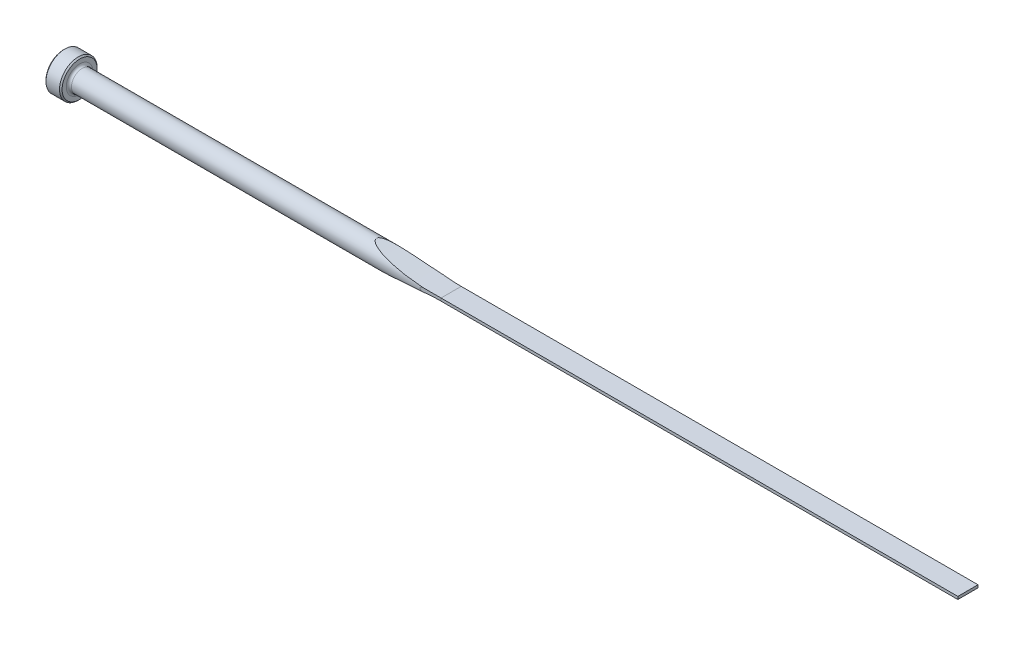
SolidWorks part; units mm, degrees
ref_plane "Front Plane" through (0, 0, 0) normal (0, 0, 1) x (1, 0, 0)
ref_plane "Top Plane" through (0, 0, 0) normal (0, 1, 0) x (1, 0, 0)
ref_plane "Right Plane" through (0, 0, 0) normal (1, 0, 0) x (0, 0, -1)
sketch "Sketch1" plane through (0, 0, 0) normal (0, 0, 1) x (1, 0, 0)
  line L0 (0, 0) -> (175.5286, 0) construction
  line L1 (0, 0) -> (0, 5.5499)
  line L2 (0, 5.5499) -> (4.7498, 5.5499)
  line L3 (4.7498, 5.5499) -> (4.7498, 3.175)
  line L4 (4.7498, 3.175) -> (266.7, 3.175)
  line L5 (266.7, 3.175) -> (266.7, 0)
  line L6 (266.7, 0) -> (0, 0)
  dimension "D1" = 266.7
  dimension "D2" = 11.0998
  dimension "D3" = 6.35
  dimension "D4" = 4.7498
revolve "Revolve1" add sketch "Sketch1" angle 360 about L0
sketch "Sketch2" plane through (0, 0, 0) normal (0, 0, 1) x (1, 0, 0)
  line L0 (266.7, 3.175) -> (266.7, 0.4064)
  line L1 (266.7, -3.175) -> (266.7, 3.175) construction
  line L2 (266.7, 0.4064) -> (114.3, 0.4064)
  line L3 (266.7, 3.175) -> (4.7498, 3.175) construction
  line L4 (92.2866, 3.175) -> (266.7, 3.175)
  line L5 (166.0833, 0) -> (153.1705, 0) construction
  arc A0 (114.3, 0.4064) -> (92.2866, 3.175) centre (114.3, 89.3064) cw
  dimension "D1" = 88.9
  dimension "D3" = 152.4
  dimension "D2" = 0.8128
  dimension "D4" = 22.0134
extrude "Cut-Extrude1" cut sketch "Sketch2" against normal through all both and the other way through all
mirror "Mirror1" about plane through (0, 0, 0) normal (0, 1, 0) of "Cut-Extrude1"
sketch "Sketch3" plane through (0, 0, 0) normal (0, 1, 0) x (1, 0, 0)
  line L0 (266.7, 3.175) -> (266.7, 2.9718)
  line L1 (266.7, 3.1489) -> (266.7, -3.1489) construction
  line L2 (266.7, 2.9718) -> (114.3, 2.9718)
  line L3 (266.7, 3.175) -> (4.7498, 3.175) construction
  line L4 (108.2927, 3.175) -> (266.7, 3.175)
  line L5 (163.4716, 0) -> (166.2513, 0) construction
  line L6 (114.3, 3.1489) -> (114.3, -3.1489) construction
  arc A0 (114.3, 2.9718) -> (108.2927, 3.175) centre (114.3, 91.8718) cw
  dimension "D2" = 88.9
  dimension "D1" = 5.9436
extrude "Cut-Extrude2" cut sketch "Sketch3" against normal through all both and the other way through all
mirror "Mirror2" about plane through (0, 0, 0) normal (0, 0, 1) of "Cut-Extrude2"
fillet "Fillet1" radius 0.762 1 edges at (4.7498, 0, 3.175)
chamfer "Chamfer1" distance 0.381 angle 45 2 edges at (0, 0, 5.5499) (4.7498, 0, 5.5499)
